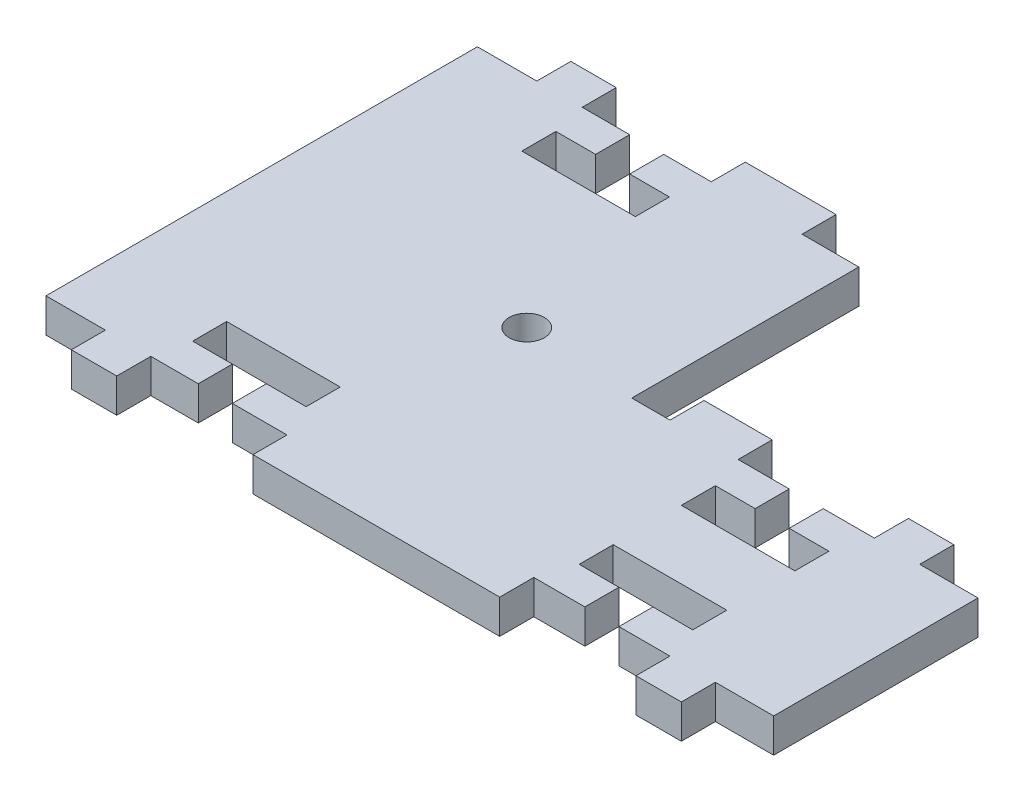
SolidWorks part; units mm, degrees
ref_plane "Front Plane" through (0, 0, 0) normal (0, 0, 1) x (1, 0, 0)
ref_plane "Top Plane" through (0, 0, 0) normal (0, 1, 0) x (1, 0, 0)
ref_plane "Right Plane" through (0, 0, 0) normal (1, 0, 0) x (0, 0, -1)
sketch "Sketch1" plane through (0, 0, 0) normal (0, 1, 0) x (1, 0, 0)
  line L123 (74.6838, 219.0941) -> (69.5519, 219.0941)
  line L124 (31.8156, 219.0941) -> (26.9997, 219.0941)
  line L125 (23.9997, 219.0941) -> (19.8156, 219.0941)
  line L126 (15.8156, 219.0941) -> (10.5838, 219.0941)
  line L127 (69.5519, 216.0941) -> (65.5519, 216.0941)
  line L128 (53.5519, 216.0941) -> (31.8156, 216.0941)
  line L129 (19.8156, 216.0941) -> (15.8156, 216.0941)
  line L130 (44.1838, 257.0941) -> (39.1838, 257.0941)
  line L131 (31.1838, 257.0941) -> (26.9997, 257.0941)
  line L132 (23.9997, 257.0941) -> (19.8156, 257.0941)
  line L133 (15.8156, 257.0941) -> (10.5838, 257.0941)
  line L134 (39.1838, 260.0941) -> (31.1838, 260.0941)
  line L135 (19.8156, 260.0941) -> (15.8156, 260.0941)
  line L136 (74.6838, 237.0941) -> (69.5519, 237.0941)
  line L137 (65.5519, 237.0941) -> (61.0519, 237.0941)
  line L138 (58.0519, 237.0941) -> (53.5519, 237.0941)
  line L139 (47.5519, 237.0941) -> (44.1838, 237.0941)
  line L140 (69.5519, 240.0941) -> (65.5519, 240.0941)
  line L141 (53.5519, 240.0941) -> (47.5519, 240.0941)
  line L142 (44.1838, 237.0941) -> (44.1838, 257.0941)
  line L143 (39.1838, 257.0941) -> (39.1838, 260.0941)
  line L144 (31.1838, 257.0941) -> (31.1838, 260.0941)
  line L145 (10.5838, 257.0941) -> (10.5838, 219.0941)
  line L146 (74.6838, 237.0941) -> (74.6838, 219.0941)
  line L147 (69.5519, 219.0941) -> (69.5519, 216.0941)
  line L148 (65.5519, 219.0941) -> (65.5519, 216.0941)
  line L149 (53.5519, 216.0941) -> (53.5519, 219.0941)
  line L150 (19.8156, 219.0941) -> (19.8156, 216.0941)
  line L151 (15.8156, 219.0941) -> (15.8156, 216.0941)
  line L152 (31.8156, 219.0941) -> (31.8156, 216.0941)
  line L153 (65.5519, 219.0941) -> (61.0519, 219.0941)
  line L154 (58.0519, 219.0941) -> (53.5519, 219.0941)
  line L155 (64.5519, 222.0941) -> (61.0519, 222.0941)
  line L156 (58.0519, 222.0941) -> (54.5519, 222.0941)
  line L157 (64.5519, 225.0941) -> (54.5519, 225.0941)
  line L158 (69.5519, 237.0941) -> (69.5519, 240.0941)
  line L159 (65.5519, 237.0941) -> (65.5519, 240.0941)
  line L160 (53.5519, 237.0941) -> (53.5519, 240.0941)
  line L161 (47.5519, 237.0941) -> (47.5519, 240.0941)
  line L162 (15.8156, 260.0941) -> (15.8156, 257.0941)
  line L163 (19.8156, 260.0941) -> (19.8156, 257.0941)
  line L164 (58.0519, 222.0941) -> (58.0519, 219.0941)
  line L165 (61.0519, 222.0941) -> (61.0519, 219.0941)
  line L166 (54.5519, 225.0941) -> (54.5519, 222.0941)
  line L167 (64.5519, 225.0941) -> (64.5519, 222.0941)
  line L168 (30.4997, 222.0941) -> (26.9997, 222.0941)
  line L169 (23.9997, 222.0941) -> (20.4997, 222.0941)
  line L170 (30.4997, 225.0941) -> (20.4997, 225.0941)
  line L171 (23.9997, 222.0941) -> (23.9997, 219.0941)
  line L172 (26.9997, 222.0941) -> (26.9997, 219.0941)
  line L173 (20.4997, 225.0941) -> (20.4997, 222.0941)
  line L174 (30.4997, 225.0941) -> (30.4997, 222.0941)
  line L175 (64.5519, 234.0941) -> (61.0519, 234.0941)
  line L176 (58.0519, 234.0941) -> (54.5519, 234.0941)
  line L177 (64.5519, 231.0941) -> (54.5519, 231.0941)
  line L178 (58.0519, 234.0941) -> (58.0519, 237.0941)
  line L179 (61.0519, 234.0941) -> (61.0519, 237.0941)
  line L180 (54.5519, 231.0941) -> (54.5519, 234.0941)
  line L181 (64.5519, 231.0941) -> (64.5519, 234.0941)
  line L182 (30.4997, 254.0941) -> (26.9997, 254.0941)
  line L183 (23.9997, 254.0941) -> (20.4997, 254.0941)
  line L184 (30.4997, 251.0941) -> (20.4997, 251.0941)
  line L185 (23.9997, 254.0941) -> (23.9997, 257.0941)
  line L186 (26.9997, 254.0941) -> (26.9997, 257.0941)
  line L187 (20.4997, 251.0941) -> (20.4997, 254.0941)
  line L188 (30.4997, 251.0941) -> (30.4997, 254.0941)
  circle A43 centre (34.1838, 237.8441) radius 1.55
extrude "Boss-Extrude1" add sketch "Sketch1" along normal blind 3
